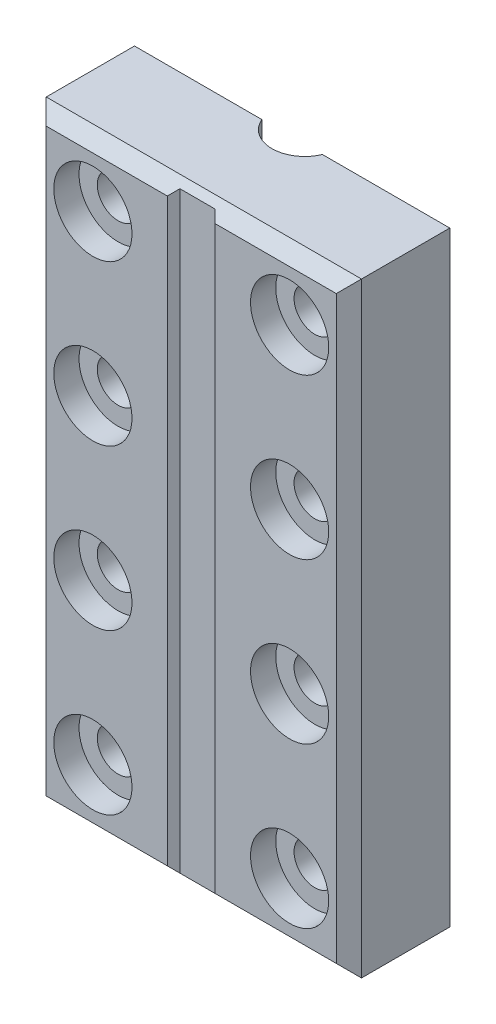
SolidWorks part; units mm, degrees
ref_plane "Спереди" through (0, 0, 0) normal (0, 0, 1) x (1, 0, 0)
ref_plane "Сверху" through (0, 0, 0) normal (0, 1, 0) x (1, 0, 0)
ref_plane "Справа" through (0, 0, 0) normal (1, 0, 0) x (0, 0, -1)
sketch "Эскиз1" plane through (0, 0, 0) normal (0, 0, 1) x (1, 0, 0)
  line L0 (-51.1, -14) -> (-61, -14) construction
  line L2 (-61, -62) -> (-51.1, -62) construction
  line L3 (-51.1, -62) -> (-51.1, -14) construction
  line L4 (-45.9, -62) -> (-36, -62) construction
  line L6 (-36, -14) -> (-45.9, -14) construction
  line L7 (-45.9, -14) -> (-45.9, -62) construction
  line L8 (-51.1, -14) -> (-61, -14) construction
  line L9 (-61, -14) -> (-61, -62)
  line L10 (-61, -62) -> (-51.1, -62) construction
  line L11 (-51.1, -62) -> (-51.1, -14) construction
  line L12 (-45.9, -62) -> (-36, -62) construction
  line L13 (-36, -62) -> (-36, -14)
  line L14 (-36, -14) -> (-45.9, -14) construction
  line L15 (-45.9, -14) -> (-45.9, -62) construction
  line L16 (-61, -62) -> (-50.9, -62)
  line L17 (-50.9, -62) -> (-50.9, -14)
  line L18 (-50.9, -14) -> (-61, -14)
  line L19 (-36, -62) -> (-46.1, -62)
  line L20 (-46.1, -62) -> (-46.1, -14)
  line L21 (-46.1, -14) -> (-36, -14)
  circle A0 centre (-40.7, -19) radius 1.65
  circle A1 centre (-56.3, -19) radius 1.65
  circle A2 centre (-56.3, -31.6667) radius 1.65
  circle A3 centre (-40.7, -31.6667) radius 1.65
  circle A4 centre (-56.3, -44.3333) radius 1.65
  circle A5 centre (-40.7, -44.3333) radius 1.65
  circle A6 centre (-56.3, -57) radius 1.65
  circle A7 centre (-40.7, -57) radius 1.65
  dimension "D2" = 3.3
  dimension "D1" = 10.1
extrude "Бобышка-Вытянуть1" add sketch "Эскиз1" along normal blind 8
sketch "Эскиз2" plane through (0, -62, 0) normal (0, -1, 0) x (1, 0, 0)
  line L0 (-50.9, 0) -> (-50.9, 8) construction
  line L1 (-50.9, 8) -> (-46.1, 8) construction
  line L2 (-46.1, 8) -> (-46.1, 0) construction
  line L3 (-50.9, 0) -> (-50.9, 7.5)
  line L4 (-50.9, 7.5) -> (-46.1, 7.5)
  line L5 (-46.1, 7.5) -> (-46.1, 0)
  arc A0 (-50.9, 0) -> (-46.1, 0) centre (-48.5, -1) cw
  circle A1 centre (-48.5, -1) radius 2.5 construction
  dimension "D1" = 1
extrude "Бобышка-Вытянуть2" add sketch "Эскиз2" against normal up to vertex
chamfer "Фаска1" distance 1 angle 45 2 edges at (-46.1, -38, 7.5) (-50.9, -38, 7.5)
chamfer "Фаска2" distance 1 angle 45 4 edges at (-41.3, -14, 8) (-36, -38, 8) (-55.7, -62, 8) (-61, -38, 8)
sketch "Эскиз3" plane through (0, 0, 8) normal (0, 0, 1) x (1, 0, 0)
  circle A0 centre (-56.3, -19) radius 3.1
  circle A1 centre (-40.7, -19) radius 3.1
  circle A2 centre (-56.3, -31.6667) radius 3.1
  circle A3 centre (-40.7, -31.6667) radius 3.1
  circle A4 centre (-40.7, -44.3333) radius 3.1
  circle A5 centre (-56.3, -44.3333) radius 3.1
  circle A6 centre (-56.3, -57) radius 3.1
  circle A7 centre (-40.7, -57) radius 3.1
  dimension "D1" = 6.2
extrude "Вырез-Вытянуть1" cut sketch "Эскиз3" against normal blind 2
